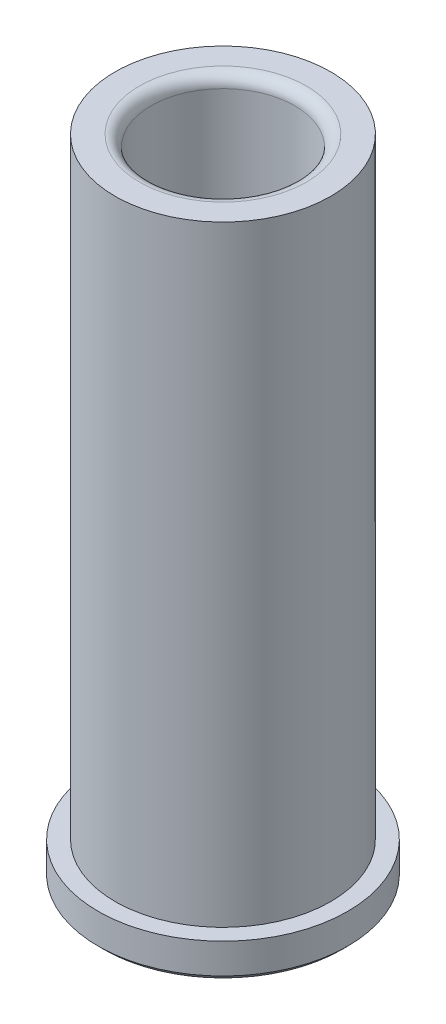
SolidWorks part; units mm, degrees
ref_plane "Front Plane" through (0, 0, 0) normal (0, 0, 1) x (1, 0, 0)
ref_plane "Top Plane" through (0, 0, 0) normal (0, 1, 0) x (1, 0, 0)
ref_plane "Right Plane" through (0, 0, 0) normal (1, 0, 0) x (0, 0, -1)
sketch "Sketch1" plane through (0, 0, 0) normal (0, 0, 1) x (1, 0, 0)
  line L0 (-15.7734, 0) -> (-16.5354, 0.762)
  line L1 (0, -1000) -> (0, 49000) construction
  line L2 (-9.5314, 85.725) -> (-9.5313, 0.762)
  line L3 (-10.2933, 0) -> (-15.7734, 0)
  line L4 (-16.5354, 0.762) -> (-16.5354, 4.7625)
  line L5 (-16.5354, 4.7625) -> (-14.2938, 4.7625)
  line L6 (-14.2939, 85.725) -> (-14.2938, 4.7625)
  line L7 (-14.2939, 85.725) -> (-9.5314, 85.725)
  line L8 (-10.2933, 0) -> (-9.5313, 0.762)
  dimension "OD" = 28.5877
  dimension "ID" = 19.0627
  dimension "H" = 33.0708
  dimension "D2" = 45
  dimension "OVERALL LENGTH" = 85.725
  dimension "D4" = 0.762
  dimension "D5" = 135
  dimension "T" = 4.7625
revolve "Revolve1" add sketch "Sketch1" angle 360 about L1
fillet "Fillet1" radius 1.524 1 edges at (9.5313, 85.725, 0)
